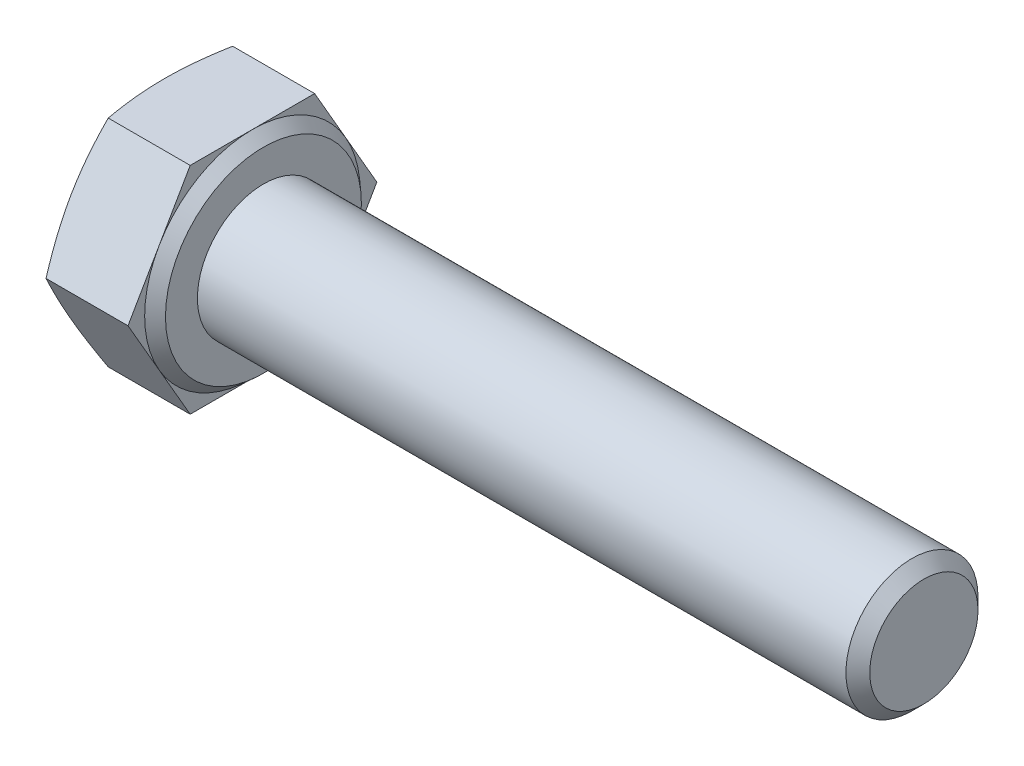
SolidWorks part; units mm, degrees
ref_plane "Front" through (0, 0, 0) normal (0, 0, 1) x (1, 0, 0)
ref_plane "Top" through (0, 0, 0) normal (0, 1, 0) x (1, 0, 0)
ref_plane "Right" through (0, 0, 0) normal (1, 0, 0) x (0, 0, -1)
sketch "Sketch-BaseHead" plane through (0, 0, 0) normal (1, 0, 0) x (0, 0, -1)
  line L1 (5.6523, 0) -> (2.8261, 4.895)
  line L2 (2.8261, 4.895) -> (-2.8261, 4.895)
  line L3 (-2.8261, 4.895) -> (-5.6523, 0)
  line L4 (-5.6523, 0) -> (-2.8261, -4.895)
  line L5 (-2.8261, -4.895) -> (2.8261, -4.895)
  line L6 (2.8261, -4.895) -> (5.6523, 0)
  circle A0 centre (0, 0) radius 4.895 construction
  dimension "s" = 9.79
extrude "BaseHead" add sketch "Sketch-BaseHead" along normal blind 4
sketch "Sketch4" plane through (-0.2646, 0, 5.9169) normal (0, 1, 0) x (0, 0, -1)
  line L0 (5.9169, 3.7369) -> (5.9169, -10.4477) construction
  line L2 (11.5692, -0.2646) -> (10.8119, -0.2646)
  line L4 (10.8119, -0.2646) -> (11.5692, -0.5403)
  line L6 (11.5692, -0.5403) -> (11.5692, -0.2646)
  dimension "D1" = 20
  dimension "D2" = 9.79
revolve "HeadChamfer" cut sketch "Sketch4" angle 360 about L0
sketch "Sketch1" plane through (0, 0, 0) normal (0, 0, 1) x (1, 0, 0)
  line L0 (4, 0) -> (4.5, 0)
  line L1 (4.5, 0) -> (4.5, -4.45)
  line L2 (4.5, -4.45) -> (4, -4.895)
  line L3 (4, -4.895) -> (4, 0) construction
  line L4 (0, 0) -> (7.5821, 0) construction
  line L5 (-4.0016, 0) -> (10.1831, 0) construction
  line L6 (4, -4.895) -> (0.2756, -4.895) construction
  line L7 (4, 0) -> (4, -4.895)
  dimension "D1" = 4.895
  dimension "c" = 0.5
  dimension "D2" = 4.45
revolve "Revolve1" add sketch "Sketch1" angle 360 about axis through (-4.0016, 0, 0) along (1, 0, 0)
ref_plane "Plane2" through (19.5, 0, 0) normal (1, 0, 0) x (0, 0, -1)
sketch "Sketch3" plane through (4.5, 0, 0) normal (1, 0, 0) x (0, 0, -1)
  circle A0 centre (0, 0) radius 3
  dimension "d" = 6
extrude "BaseBody" add sketch "Sketch3" along normal blind 30
fillet "HeadFillet" [suppressed] radius 0.25
chamfer "Chamfer1" distance 0.5415 angle 45 1 edges at (34.5, 0, -3)
sketch "Sketch5" plane through (0, 0, 0) normal (0, 0, 1) x (1, 0, 0)
  line L0 (33.417, 3.5415) -> (33.9585, 3.5415)
  line L1 (33.9585, 3.5415) -> (33.9585, 3)
  line L2 (33.9585, 3) -> (33.6877, 2.531)
  line L3 (33.6877, 2.531) -> (33.417, 3)
  line L4 (33.417, 3) -> (33.417, 3.5415)
  line L5 (33.9585, -3) -> (33.9585, 3) construction
  line L6 (33.9585, 3) -> (4.5, 3) construction
  dimension "D1" = 0.5415
revolve "Cut-Revolve10" [suppressed] cut sketch "Sketch5" angle 360
pattern_linear "LPattern10" [suppressed] count 23
equation "\"D1@Sketch1\" = \"s@Sketch-BaseHead\"/ 2"
equation "\"D2@Sketch4\" = \"s@Sketch-BaseHead\""
equation "\"D1@Chamfer1\" =  ( \"d@Sketch3\" - \"D2@ThreadCosmetic1\" ) / 2 "
equation "\"b@ThreadCosmetic1\" = \"l@BaseBody\" - \"lg@Plane2\""
equation "\"D1@Sketch5\" =  (\"d@Sketch3\" - \"D2@ThreadCosmetic1\" )  / 2 "
equation "\"pitch@LPattern10\" = 1.2 * \"D1@Sketch5\""
equation "\"D1@LPattern10\" = \"b@ThreadCosmetic1\" / \"pitch@LPattern10\""
